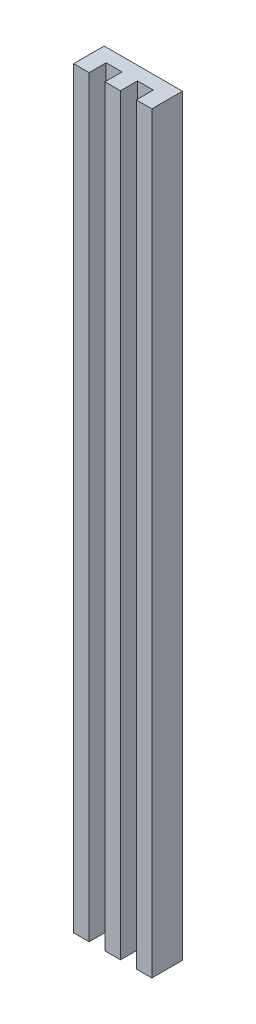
SolidWorks part; units mm, degrees
ref_plane "Plan de face" through (0, 0, 0) normal (0, 0, 1) x (1, 0, 0)
ref_plane "Plan de dessus" through (0, 0, 0) normal (0, 1, 0) x (1, 0, 0)
ref_plane "Plan de droite" through (0, 0, 0) normal (1, 0, 0) x (0, 0, -1)
sketch "Esquisse1" plane through (0, 0, 0) normal (0, 1, 0) x (1, 0, 0)
  line L0 (0, 0) -> (0, 6.1)
  line L1 (0, 6.1) -> (15.6, 6.1)
  line L2 (15.6, 6.1) -> (15.6, 0)
  line L3 (15.6, 0) -> (12.5, 0)
  line L4 (12.5, 0) -> (12.5, 3.4)
  line L5 (12.5, 3.4) -> (9.35, 3.4)
  line L6 (9.35, 3.4) -> (9.35, 0)
  line L8 (9.35, 0) -> (6.25, 0)
  line L9 (6.25, 0) -> (6.25, 3.4)
  line L10 (6.25, 3.4) -> (3.1, 3.4)
  line L11 (3.1, 3.4) -> (3.1, 0)
  line L12 (3.1, 0) -> (0, 0)
  point P13 (5.2624, 1.7443)
  dimension "D1" = 15.6
  dimension "D2" = 3.1
  dimension "D3" = 6.1
  dimension "D4" = 3.4
extrude "Boss.-Extru.1" add sketch "Esquisse1" along normal mid plane 150
